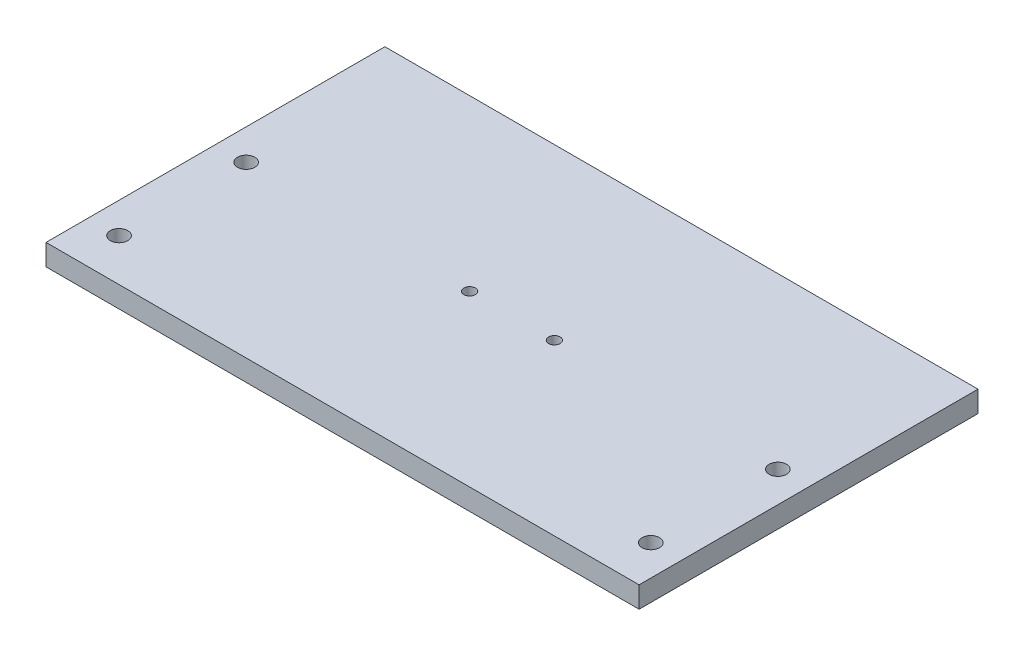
SolidWorks part; units mm, degrees
ref_plane "Front" through (0, 0, 0) normal (0, 0, 1) x (1, 0, 0)
ref_plane "Top" through (0, 0, 0) normal (0, 1, 0) x (1, 0, 0)
ref_plane "Right" through (0, 0, 0) normal (1, 0, 0) x (0, 0, -1)
sketch "Sketch1" plane through (0, 0, 0) normal (1, 0, 0) x (0, 0, -1)
  line L1 (0, 0) -> (101.6, 0)
  line L2 (0, 0) -> (0, -6.35)
  line L3 (0, -6.35) -> (101.6, -6.35)
  line L4 (101.6, 0) -> (101.6, -6.35)
  dimension "D1" = 6.35
  dimension "D2" = 101.6
extrude "Extrude1" add sketch "Sketch1" along normal up to surface (177.8 mm away)
ref_plane "Plane1" through (88.9, 0, 0) normal (-1, 0, 0) x (0, 0, 1)
sketch "Sketch3" plane through (0, 0, 0) normal (0, 1, 0) x (-1, 0, 0)
  line L0 (-177.8, 0) -> (0, 0) construction
  line L1 (-177.8, -101.6) -> (-177.8, 0) construction
  line L2 (0, -101.6) -> (0, 0) construction
  line L3 (-88.9, -3.4925) -> (-88.9, 3.4925) construction
  circle A0 centre (-76.2, -50.8) radius 1.7272
  circle A1 centre (-101.6, -50.8) radius 1.7272
  circle A2 centre (-168.6052, -50.8) radius 2.6162
  circle A3 centre (-168.6052, -12.7) radius 2.6162
  circle A4 centre (-9.1948, -12.7) radius 2.6162
  circle A5 centre (-9.1948, -50.8) radius 2.6162
  dimension "D5" = 5.2324
  dimension "D6" = 3.4544
  dimension "D1" = 12.7
  dimension "D2" = 50.8
  dimension "D3" = 9.1948
  dimension "D4" = 9.1948
  dimension "D7" = 12.7
  dimension "D8" = 12.7
  dimension "D9" = 50.8
extrude "Cut-Extrude1" cut sketch "Sketch3" against normal through all
